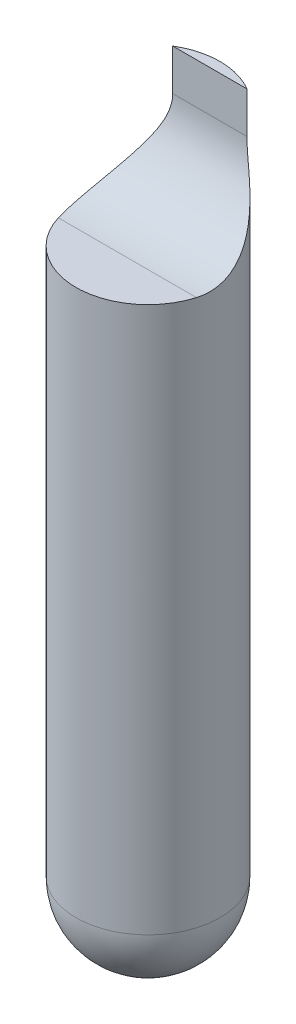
SolidWorks part; units mm, degrees
ref_plane "Front Plane" through (0, 0, 0) normal (0, 0, 1) x (1, 0, 0)
ref_plane "Top Plane" through (0, 0, 0) normal (0, 1, 0) x (1, 0, 0)
ref_plane "Right Plane" through (0, 0, 0) normal (1, 0, 0) x (0, 0, -1)
sketch "Sketch2" plane through (0, 0, 0) normal (0, 1, 0) x (1, 0, 0)
  circle A0 centre (0, 0) radius 44.45
  dimension "D1" = 88.9
extrude "Boss-Extrude1" add sketch "Sketch2" along normal blind 457.2
fillet "Fillet1" radius 44.45 1 edges at (0, 0, 44.45)
sketch "Sketch3" plane through (0, 0, 0) normal (-1, 0, 0) x (0, 0, 1)
  line L0 (-38.1, 431.8) -> (-38.1, 457.2)
  line L1 (44.45, 457.2) -> (-44.45, 457.2) construction
  line L2 (-38.1, 457.2) -> (12.7, 457.2)
  line L3 (12.7, 381) -> (56.534, 381)
  line L4 (56.534, 381) -> (56.534, 457.2)
  line L5 (56.534, 457.2) -> (12.7, 457.2)
  arc A0 (-38.1, 431.8) -> (12.7, 381) centre (12.7, 431.8) ccw
  dimension "D2" = 50.8
  dimension "D1" = 25.4
  dimension "D3" = 12.7
extrude "Cut-Extrude1" cut sketch "Sketch3" against normal through all and the other way through all
